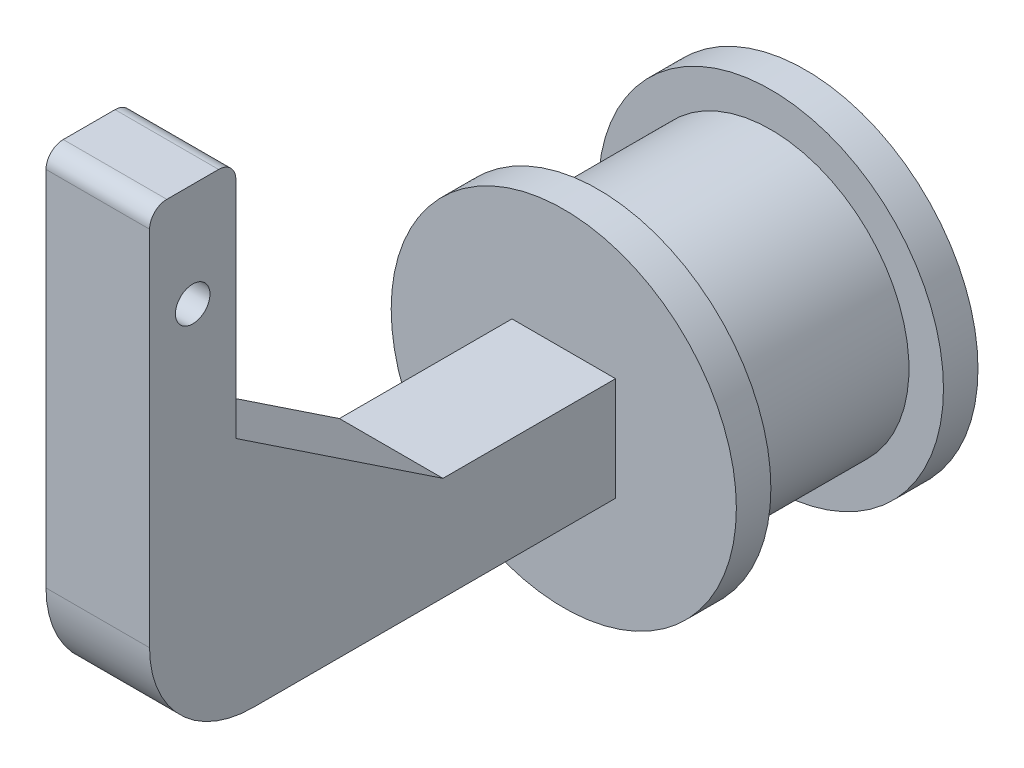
SolidWorks part; units mm, degrees
ref_plane "Front Plane" through (0, 0, 0) normal (0, 0, 1) x (1, 0, 0)
ref_plane "Top Plane" through (0, 0, 0) normal (0, 1, 0) x (1, 0, 0)
ref_plane "Right Plane" through (0, 0, 0) normal (1, 0, 0) x (0, 0, -1)
sketch "Sketch1" plane through (0, 0, 0) normal (0, 0, 1) x (1, 0, 0)
  circle A0 centre (0, 0) radius 40
extrude "Boss-Extrude1" add sketch "Sketch1" along normal blind 30
sketch "Sketch3" plane through (0, 0, 30) normal (0, 0, 1) x (1, 0, 0)
  line L1 (-15, 15) -> (15, 15)
  line L2 (-15, 15) -> (-15, -15)
  line L3 (-15, -15) -> (15, -15)
  line L4 (15, 15) -> (15, -15)
  line L5 (-15, 15) -> (15, -15) construction
  line L6 (-15, -15) -> (15, 15) construction
  point P0 (0, 0)
extrude "Boss-Extrude2" add sketch "Sketch3" along normal blind 120
sketch "Sketch4" plane through (0, -15, 0) normal (0, -1, 0) x (1, 0, 0)
  line L1 (-15, 150) -> (15, 150)
  line L2 (-15, 150) -> (-15, 175)
  line L3 (-15, 175) -> (15, 175)
  line L4 (15, 150) -> (15, 175)
extrude "Boss-Extrude3" add sketch "Sketch4" against normal blind 140 separate body
sketch "Sketch6" plane through (-15, 0, 0) normal (-1, 0, 0) x (0, 0, 1)
  line L0 (162.5, 125) -> (162.5, 95) construction
  line L1 (175, 125) -> (150, 125) construction
  circle A0 centre (162.5, 95) radius 5
extrude "Cut-Extrude1" cut sketch "Sketch6" against normal blind 30
sketch "Sketch7" plane through (-15, 0, 0) normal (-1, 0, 0) x (0, 0, 1)
  line L0 (150, 15) -> (90, 15)
  line L1 (150, 15) -> (30, 15) construction
  line L2 (90, 15) -> (150, 55)
  line L3 (150, 125) -> (150, -15) construction
  line L4 (150, 55) -> (150, 15)
extrude "Boss-Extrude4" add sketch "Sketch7" against normal blind 30
fillet "Fillet2" radius 30 1 edges at (0, -15, 175)
fillet "Fillet3" radius 5 1 edges at (0, 125, 150)
fillet "Fillet4" radius 5 1 edges at (0, 125, 175)
sketch "Sketch8" plane through (0, 0, 0) normal (0, 0, -1) x (-1, 0, 0)
  circle A0 centre (0, 0) radius 40
extrude "Boss-Extrude5" add sketch "Sketch8" along normal blind 20
sketch "Sketch9" plane through (0, 0, -20) normal (0, 0, -1) x (-1, 0, 0)
  circle A0 centre (0, 0) radius 50
extrude "Boss-Extrude6" add sketch "Sketch9" along normal blind 10
sketch "Sketch10" plane through (0, 0, 30) normal (0, 0, 1) x (1, 0, 0)
  circle A0 centre (0, 0) radius 50
extrude "Boss-Extrude7" add sketch "Sketch10" along normal blind 10
